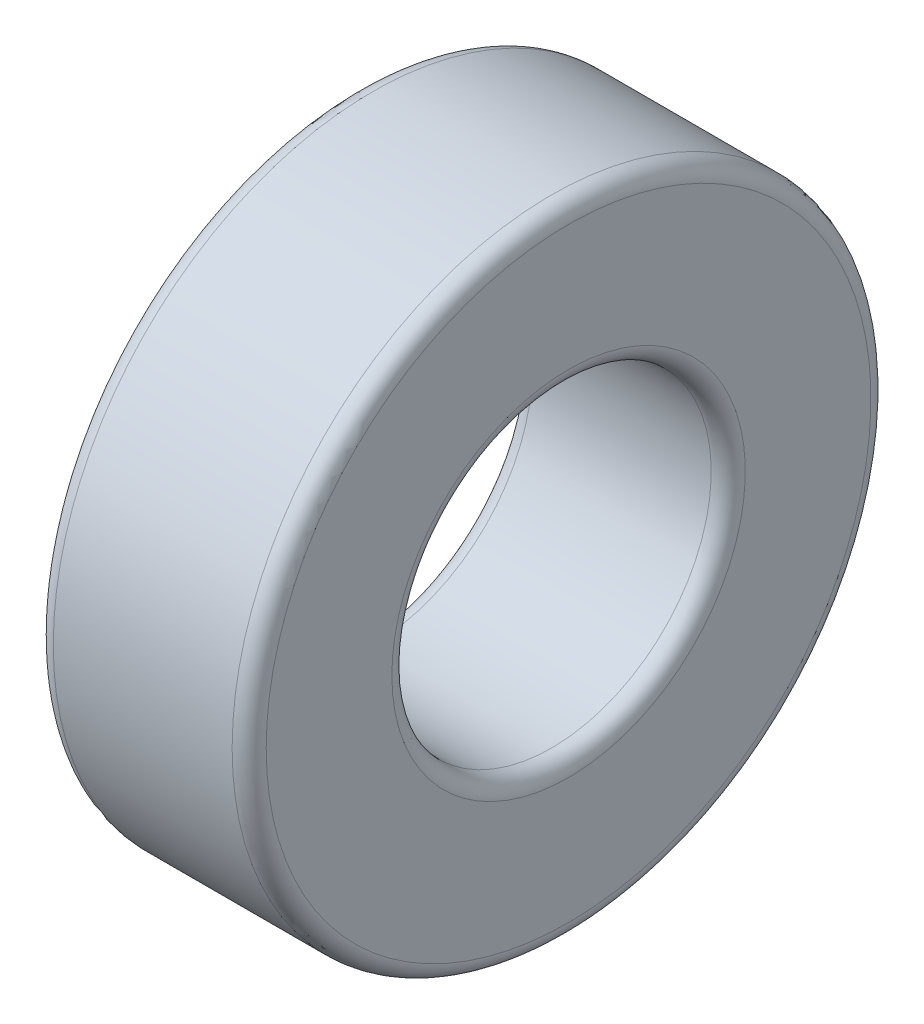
SolidWorks part; units mm, degrees
ref_plane "Front Plane" through (0, 0, 0) normal (0, 0, 1) x (1, 0, 0)
ref_plane "Top Plane" through (0, 0, 0) normal (0, 1, 0) x (1, 0, 0)
ref_plane "Right Plane" through (0, 0, 0) normal (1, 0, 0) x (0, 0, -1)
sketch "Sketch1" plane through (0, 0, 0) normal (0, 0, 1) x (1, 0, 0)
  line L0 (0, 0) -> (6.9241, 0) construction
  line L1 (0, 0) -> (0, 8.6187) construction
  line L2 (-1.5875, 2.3813) -> (1.5875, 2.3813)
  line L3 (-1.5875, 2.3813) -> (-1.5875, 4.7625)
  line L4 (-1.5875, 4.7625) -> (1.5875, 4.7625)
  line L5 (1.5875, 2.3813) -> (1.5875, 4.7625)
  dimension "D1" = 4.7625
  dimension "D2" = 9.525
  dimension "D3" = 3.175
revolve "Revolve1" add sketch "Sketch1" angle 360 about L0
fillet "Fillet2" radius 0.254 4 edges at (-1.5875, 0, 4.7625) (-1.5875, 0, 2.3813) (1.5875, 0, 4.7625) (1.5875, 0, 2.3813)
